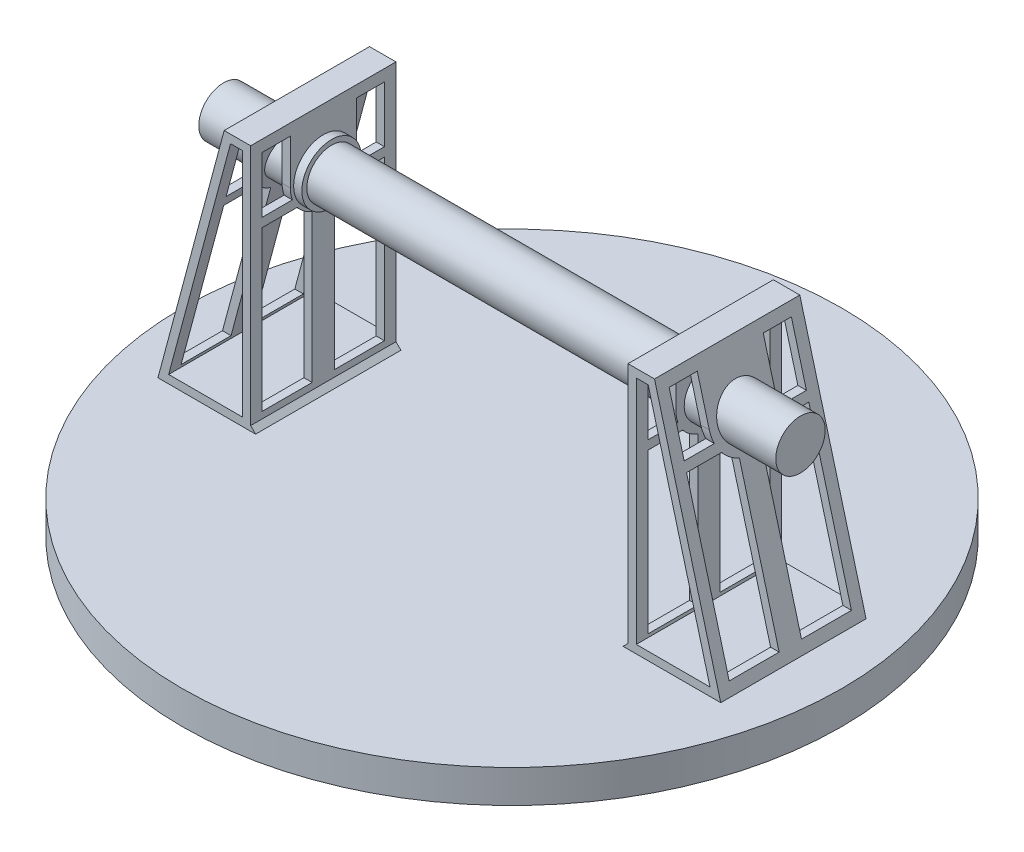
SolidWorks part; units mm, degrees
ref_plane "Front Plane" through (0, 0, 0) normal (0, 0, 1) x (1, 0, 0)
ref_plane "Top Plane" through (0, 0, 0) normal (0, 1, 0) x (1, 0, 0)
ref_plane "Right Plane" through (0, 0, 0) normal (1, 0, 0) x (0, 0, -1)
sketch "Sketch1" plane through (0, 0, 0) normal (0, 1, 0) x (1, 0, 0)
  circle A0 centre (0, 0) radius 5
  dimension "D1" = 10
extrude "Boss-Extrude1" add sketch "Sketch1" along normal blind 10
sketch "Sketch2" plane through (0, 10, 0) normal (0, 1, 0) x (1, 0, 0)
  circle A2 centre (0, 0) radius 10
  circle A3 centre (0, 0) radius 10
  dimension "D1" = 5
extrude "Boss-Extrude2" add sketch "Sketch2" along normal blind 3
sketch "Sketch3" plane through (0, 13, 0) normal (0, 1, 0) x (1, 0, 0)
  circle A0 centre (0, 0) radius 200
  dimension "D1" = 400
extrude "Boss-Extrude3" add sketch "Sketch3" along normal blind 20
sketch "Sketch4" plane through (0, 33, 0) normal (0, 1, 0) x (1, 0, 0)
  line L1 (-114.4623, -44.0755) -> (-170.7027, -44.0755)
  line L2 (-114.4623, -44.0755) -> (-114.4623, 44.0755)
  line L3 (-114.4623, 44.0755) -> (-170.7027, 44.0755)
  line L4 (-170.7027, -44.0755) -> (-170.7027, 44.0755)
  line L5 (-114.4623, -44.0755) -> (-170.7027, 44.0755) construction
  line L6 (-114.4623, 44.0755) -> (-170.7027, -44.0755) construction
  point P0 (-142.5825, 0)
  point P5 (-142.2357, 4.3411)
  point P6 (-134.29, -39.7336)
  point P7 (0, 0)
  point P8 (0, 0)
  point P9 (0, 0)
extrude "Boss-Extrude4" add sketch "Sketch4" along normal blind 150
draft "Draft1" type of draft neutral plane draft angle 15 faces to draft 1 parameters "D1"=15
sketch "Sketch5" plane through (0, 0, 44.0755) normal (0, 0, 1) x (1, 0, 0)
  line L8 (-164.1865, 38) -> (-119.4623, 38)
  line L9 (-119.4623, 38) -> (-119.4623, 178)
  line L10 (-119.4623, 178) -> (-126.6737, 178)
  line L11 (-126.6737, 178) -> (-164.1865, 38)
  line L12 (-164.1865, 38) -> (-119.4623, 38)
  line L13 (-119.4623, 38) -> (-119.4623, 178)
  line L14 (-119.4623, 178) -> (-126.6737, 178)
  line L15 (-126.6737, 178) -> (-164.1865, 38)
  dimension "D1" = 5
extrude "Cut-Extrude1" cut sketch "Sketch5" against normal through all
sketch "Sketch6" plane through (-114.4623, 0, 0) normal (1, 0, 0) x (0, 0, -1)
  line L4 (-20, 148.7615) -> (-20, 176)
  line L5 (20, 148.7615) -> (20, 176)
  line L6 (0, 148.7615) -> (0, 40) construction
  line L7 (-6.7842, 129.9473) -> (-6.7842, 40)
  line L8 (-37.0755, 40) -> (37.0755, 40)
  line L9 (37.0755, 40) -> (37.0755, 176)
  line L10 (37.0755, 176) -> (-37.0755, 176)
  line L11 (-37.0755, 176) -> (-37.0755, 40)
  line L12 (-37.0755, 40) -> (37.0755, 40)
  line L13 (37.0755, 40) -> (37.0755, 176)
  line L14 (37.0755, 176) -> (-37.0755, 176)
  line L15 (-37.0755, 176) -> (-37.0755, 40)
  line L16 (6.7842, 129.9473) -> (6.7842, 40)
  line L17 (-37.0755, 141.9244) -> (-18.795, 141.9244)
  line L18 (18.795, 141.9244) -> (37.0755, 141.9244)
  line L19 (-37.0755, 136.505) -> (-15.8043, 136.505)
  line L20 (15.8043, 136.505) -> (37.0755, 136.505)
  circle A0 centre (0, 148.7615) radius 15
  arc A1 (-20, 148.7615) -> (-18.795, 141.9244) centre (0, 148.7615) ccw
  arc A2 (6.7842, 129.9473) -> (15.8043, 136.505) centre (0, 148.7615) ccw
  circle A3 centre (0, 148.7615) radius 20 construction
  arc A4 (18.795, 141.9244) -> (20, 148.7615) centre (0, 148.7615) ccw
  arc A5 (-15.8043, 136.505) -> (-6.7842, 129.9473) centre (0, 148.7615) ccw
  point P12 (20, 148.7615)
  dimension "D1" = 30
  dimension "D2" = 5
  dimension "D3" = 7
extrude "Cut-Extrude2" cut sketch "Sketch6" against normal blind 130 contours A5 L19 L15 L12 L7 | A2 L16 L12 L13 L20 | A0 | A1 L4 L14 L15 L17 | A4 L18 L13 L14 L5
mirror "Mirror2" about plane through (0, 0, 0) normal (1, 0, 0)
sketch "Sketch7" plane through (0, 0, 0) normal (1, 0, 0) x (0, 0, -1)
  circle A0 centre (0, 148.7615) radius 15 construction
  circle A1 centre (0, 148.7615) radius 15
extrude "Boss-Extrude5" add sketch "Sketch7" along normal mid plane 350
sketch "Sketch8" plane through (114.4623, 0, 0) normal (-1, 0, 0) x (0, 0, 1)
  line L4 (-44.0755, 33) -> (44.0755, 33)
  line L5 (44.0755, 33) -> (44.0755, 183)
  line L6 (44.0755, 183) -> (-44.0755, 183)
  line L7 (-44.0755, 183) -> (-44.0755, 33)
  line L8 (-44.0755, 33) -> (44.0755, 33)
  line L9 (44.0755, 33) -> (44.0755, 183)
  line L10 (44.0755, 183) -> (-44.0755, 183)
  line L11 (-44.0755, 183) -> (-44.0755, 33)
  circle A0 centre (0, 148.7615) radius 15 construction
  circle A1 centre (0, 148.7615) radius 15
  circle A2 centre (0, 148.7615) radius 18
  dimension "D1" = 0
  dimension "D2" = 3
extrude "Boss-Extrude6" add sketch "Sketch8" along normal blind 5 contours A2 M19
mirror "Mirror3" about plane through (0, 0, 0) normal (1, 0, 0) of "Boss-Extrude6"
chamfer "Chamfer1" distance 3 angle 45 1 edges at (114.4623, 33, 0)
chamfer "Chamfer2" distance 3 angle 45 1 edges at (-114.4623, 33, 0)
